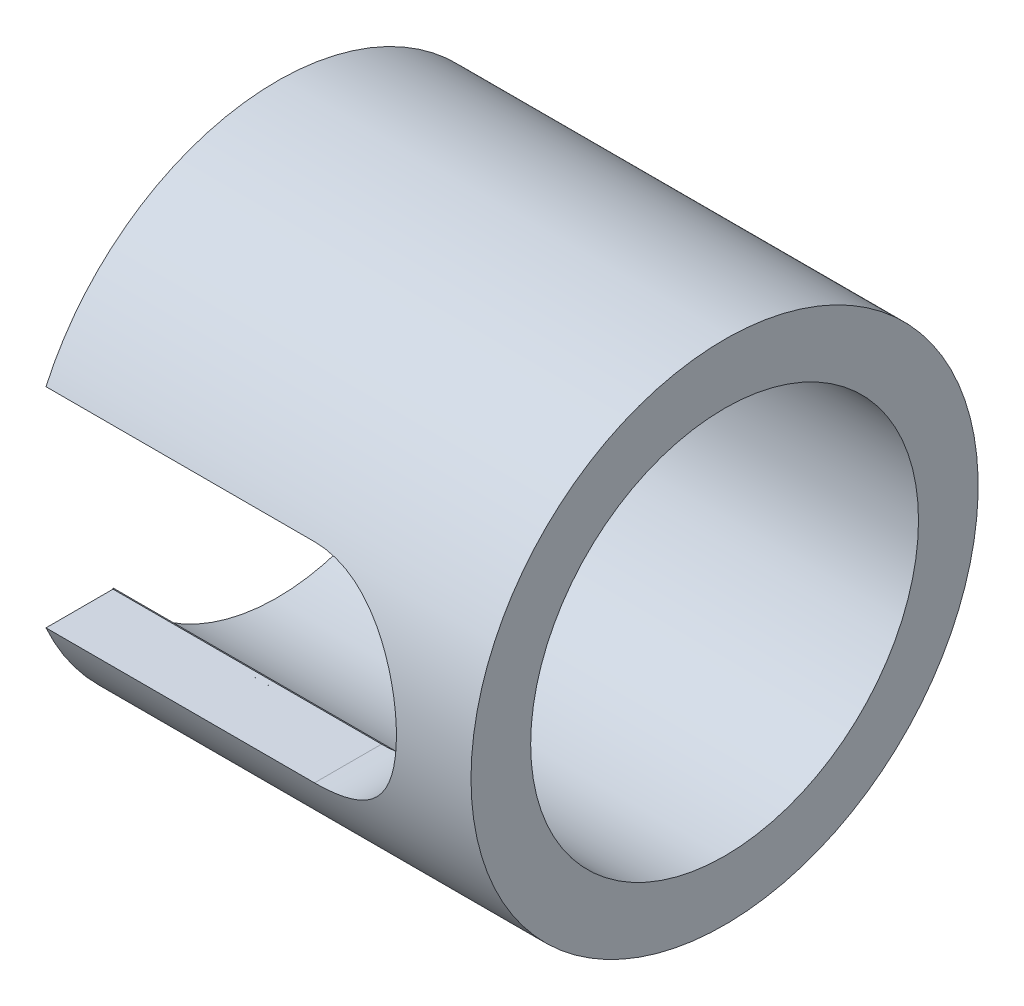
SolidWorks part; units mm, degrees
ref_plane "Plan1" through (0, 0, 0) normal (0, 0, 1) x (1, 0, 0)
ref_plane "Plan2" through (0, 0, 0) normal (0, 1, 0) x (1, 0, 0)
ref_plane "Plan3" through (0, 0, 0) normal (1, 0, 0) x (0, 0, -1)
sketch "Esquisse1" plane through (0, 0, 0) normal (0, 0, 1) x (1, 0, 0)
  line L0 (-100, 7.5) -> (110, 7.5) construction
  line L1 (-60, 14) -> (-60, 16)
  line L2 (-60, 16) -> (-45, 16)
  line L3 (-45, 16) -> (-45, 14)
  line L4 (-60, 14) -> (-45, 14)
  dimension "D1" = 15
  dimension "D2" = 8.5
  dimension "D3" = 2
revolve "Base-Révolution" add sketch "Esquisse1" angle 360 about L0
ref_plane "Plan4" through (0, 0, 8.5) normal (0, 0, 1) x (1, 0, 0)
sketch "Esquisse2" plane through (0, 0, 8.5) normal (0, 0, 1) x (1, 0, 0)
  line L0 (-60, 7.5) -> (-45, 7.5) construction
  line L1 (-60, 16) -> (-60, -1) construction
  line L2 (-45, -1) -> (-45, 16) construction
  line L3 (-60, 11) -> (-51, 11)
  line L4 (-60, 4) -> (-51, 4)
  line L6 (-60, 11) -> (-60, 4)
  arc A0 (-51, 4) -> (-51, 11) centre (-51, 7.5) ccw
  dimension "D1" = 3.5
  dimension "D2" = 3.5
  dimension "D3" = 6
extrude "Enlèv. mat.-Extru.1" cut sketch "Esquisse2" against normal blind 3
